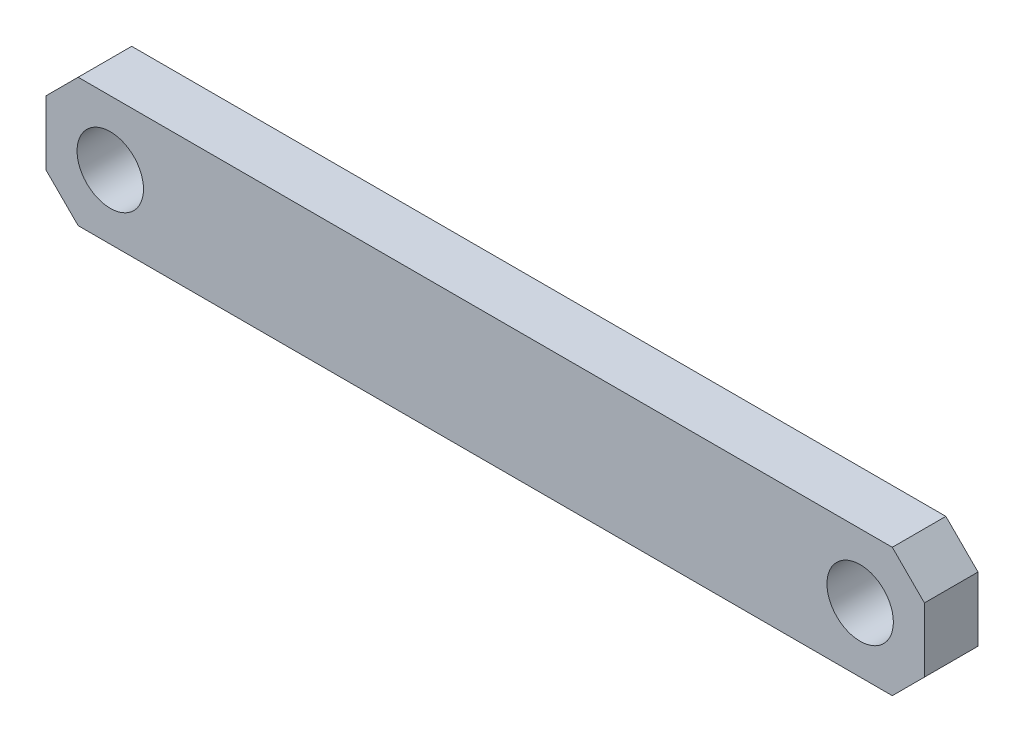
SolidWorks part; units mm, degrees
ref_plane "前视基准面" through (0, 0, 0) normal (0, 0, 1) x (1, 0, 0)
ref_plane "上视基准面" through (0, 0, 0) normal (0, 1, 0) x (1, 0, 0)
ref_plane "右视基准面" through (0, 0, 0) normal (1, 0, 0) x (0, 0, -1)
other "Configuration Table"
sketch "草图1" plane through (0, 0, 0) normal (0, 0, 1) x (1, 0, 0)
  line L0 (-6, -3) -> (-3, -6)
  line L1 (-3, -6) -> (73, -6)
  line L2 (73, -6) -> (76, -3)
  line L3 (76, -3) -> (76, 3)
  line L4 (76, 3) -> (73, 6)
  line L5 (73, 6) -> (-3, 6)
  line L6 (-3, 6) -> (-6, 3)
  line L7 (-6, 3) -> (-6, -3)
  dimension "D1" = 73
  dimension "D2" = 76
  dimension "D3" = 3
  dimension "D4" = 3
  dimension "D5" = 6
  dimension "D6" = 3
extrude "Link_Pitch70" add sketch "草图1" against normal mid plane 5
sketch "草图2" plane through (0, 0, 0) normal (0, 0, 1) x (1, 0, 0)
  circle A0 centre (0, 0) radius 3.1
  circle A1 centre (70, 0) radius 3.1
  dimension "D1" = 6.2
  dimension "D2" = 70
extrude "Pivot_Bores_D6_2" cut sketch "草图2" against normal mid plane 500
